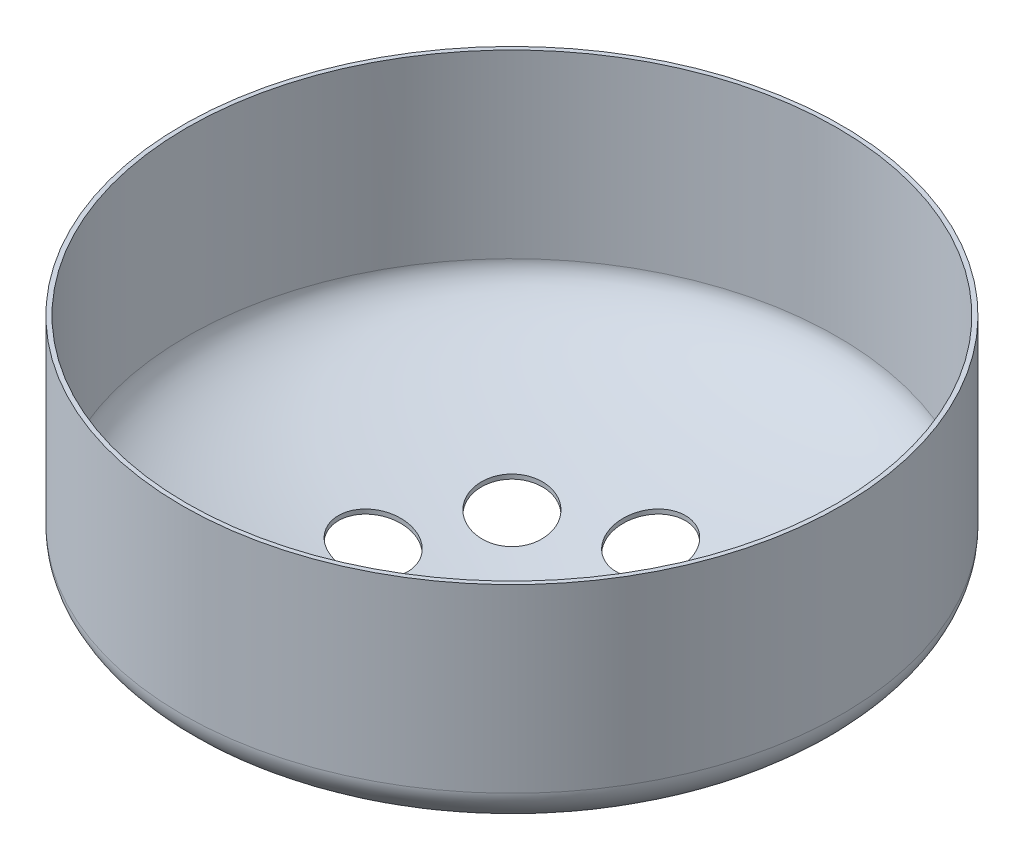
SolidWorks part; units mm, degrees
ref_plane "Vorne" through (0, 0, 0) normal (0, 0, 1) x (1, 0, 0)
ref_plane "Oben" through (0, 0, 0) normal (0, 1, 0) x (1, 0, 0)
ref_plane "Rechts" through (0, 0, 0) normal (1, 0, 0) x (0, 0, -1)
sketch "Skizze1" plane through (0, 0, 0) normal (1, 0, 0) x (0, 0, -1)
  line L0 (0, 182.5319) -> (0, -33.248) construction
  line L1 (190, 165) -> (0, 165)
  line L2 (0, 165) -> (0, 0)
  line L3 (0, 0) -> (30, 0)
  line L5 (190, 165) -> (190, 60.7998)
  ellipse E2 centre (-187.7804, 60.7998) end of major axis (190, 60.7998) minor radius 74.4079 (30, 0) -> (190, 60.7998) ccw
  dimension "D1" = 30
  dimension "D8" = 104.2002
  dimension "D2" = 165
  dimension "D3" = 380
revolve "Rotation1" add sketch "Skizze1" angle 360 about L0
shell "Wandung1" thickness 2.5
sketch "Skizze2" plane through (0, 0, 0) normal (0, -1, 0) x (1, 0, 0)
  circle A0 centre (0, 0) radius 9.25
  dimension "D1" = 18.5
extrude "Linear austragen1" cut sketch "Skizze2" against normal through all
sketch "Skizze3" plane through (0, 0, 0) normal (0, 1, 0) x (1, 0, 0)
  circle A0 centre (80, 0) radius 20
  dimension "D2" = 40
  dimension "D1" = 80
extrude "Linear austragen2" cut sketch "Skizze3" along normal through all
pattern_circular "Kreismuster1" count 8 every 45 about axis through (0, 0, 0) along (0, 1, 0) of "Linear austragen2"
